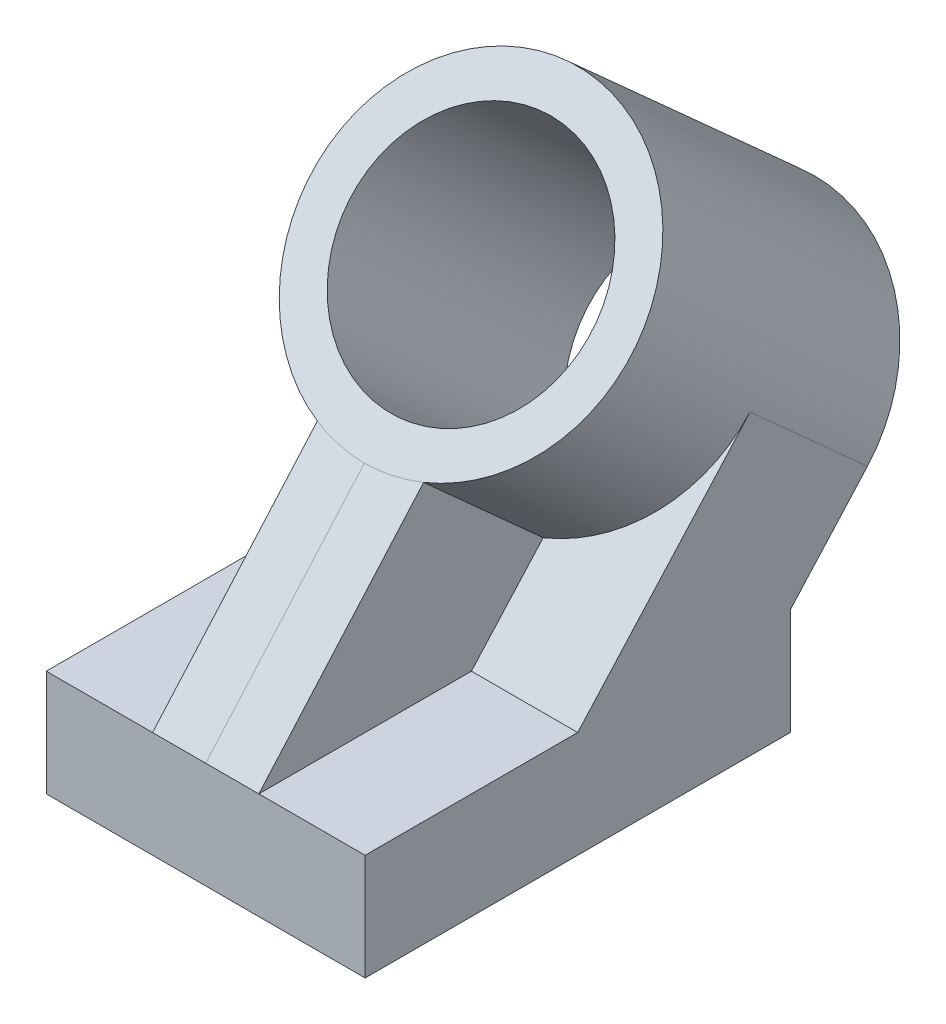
SolidWorks part; units mm, degrees
ref_plane "Front Plane" through (0, 0, 0) normal (0, 0, 1) x (1, 0, 0)
ref_plane "Top Plane" through (0, 0, 0) normal (0, 1, 0) x (1, 0, 0)
ref_plane "Right Plane" through (0, 0, 0) normal (1, 0, 0) x (0, 0, -1)
sketch "Sketch1" plane through (0, 0, 0) normal (1, 0, 0) x (0, 0, -1)
  line L0 (0, 0) -> (50.8, 0)
  line L1 (0, 0) -> (0, -25.4)
  line L2 (0, -25.4) -> (101.6, -25.4)
  line L3 (101.6, -25.4) -> (101.6, 0)
  line L4 (101.6, 0) -> (120.0427, 20.4827)
  line L5 (101.6, 0) -> (131.3247, 0) construction
  line L6 (50.8, 0) -> (91.9877, 45.7436)
  line L8 (120.0427, 20.4827) -> (91.9877, 45.7436)
  dimension "D1" = 50.8
  dimension "D2" = 25.4
  dimension "D3" = 101.6
  dimension "D4" = 48
extrude "Boss-Extrude1" add sketch "Sketch1" against normal blind 76.2
sketch "Sketch2" plane through (0, -25.2609, -28.055) normal (0, 0.6691, 0.7431) x (1, 0, 0)
  line L0 (-38.1, -18.8759) -> (-38.1, 95.4241) construction
  line L1 (-76.2, -18.8759) -> (0, -18.8759) construction
  dimension "D1" = 114.3
sketch "Sketch3" plane through (0, -25.2609, -28.055) normal (0, 0.6691, 0.7431) x (1, 0, 0)
  line L0 (-76.2, 95.5459) -> (0, 95.5459)
  arc A0 (-76.2, 95.5459) -> (0, 95.5459) centre (-38.1, 95.5459) ccw
extrude "Cut-Extrude2" cut sketch "Sketch3" against normal up to surface (37.7518 mm away)
sketch "Sketch5" plane through (0, -50.5217, -56.11) normal (0, -0.6691, -0.7431) x (-1, 0, 0)
  line L0 (38.1, 95.5459) -> (0, 95.5459) construction
  arc A0 (0, 95.5459) -> (76.2, 95.5459) centre (38.1, 95.5459) ccw construction
  circle A1 centre (38.1, 95.5459) radius 38.1
  circle A2 centre (38.1, 95.5459) radius 28.575
  dimension "D1" = 9.525
extrude "Boss-Extrude2" add sketch "Sketch5" against normal blind 76.2
sketch "Sketch6" plane through (0, -50.5217, -56.11) normal (0, -0.6691, -0.7431) x (-1, 0, 0)
  arc A0 (45.6403, 67.9837) -> (30.5597, 67.9837) centre (38.1, 95.5459) ccw construction
  circle A1 centre (38.1, 95.5459) radius 28.575
extrude "Boss-Extrude4" [suppressed] add sketch "Sketch6" against normal blind 9.525
ref_plane "Plane1" through (-38.1, 0, 0) normal (1, 0, 0) x (0, 0, -1)
sketch "Sketch9" plane through (-38.1, 0, 0) normal (1, 0, 0) x (0, 0, -1)
  line L0 (50.8, 0) -> (0, 0)
  line L1 (50.8, 0) -> (0, 0)
  line L2 (66.4938, 17.4297) -> (50.8, 0)
  line L3 (66.4938, 17.4297) -> (50.8, 0)
  line L4 (37.9212, 43.1566) -> (66.4938, 17.4297)
  line L5 (145.5366, 48.7965) -> (88.9089, 99.7843)
  line L7 (37.9212, 43.1566) -> (66.4938, 17.4297)
  line L8 (0, 0) -> (37.9212, 43.1566)
ref_plane "Plane2" through (-25.4, 0, 0) normal (1, 0, 0) x (0, 0, -1)
sketch "Sketch11" plane through (-25.4, 0, 0) normal (1, 0, 0) x (0, 0, -1)
  line L0 (50.8, 0) -> (0, 0)
  line L1 (50.8, 0) -> (0, 0)
  line L2 (67.9518, 19.049) -> (50.8, 0)
  line L3 (67.9518, 19.049) -> (50.8, 0)
  line L4 (39.3792, 44.7759) -> (67.9518, 19.049)
  line L5 (144.0786, 47.1772) -> (87.4509, 98.165)
  line L6 (0, 0) -> (39.3792, 44.7759)
  line L7 (39.3792, 44.7759) -> (67.9518, 19.049)
sketch "Sketch12" plane through (0, 0.466, 0.5176) normal (0, 0.6691, 0.7431) x (1, 0, 0)
  circle A0 centre (-38.1, 95.5459) radius 38.1 construction
  circle A1 centre (-38.1, 95.5459) radius 38.1
sketch "Sketch13" plane through (0, 0, 0) normal (0, 1, 0) x (1, 0, 0)
  line L0 (-38.1, 0) -> (-25.4, 0)
loft "Loft2" add profiles "Sketch9", "Sketch11"
mirror "Mirror1" about plane through (-38.1, 0, 0) normal (1, 0, 0) of "Loft2"
